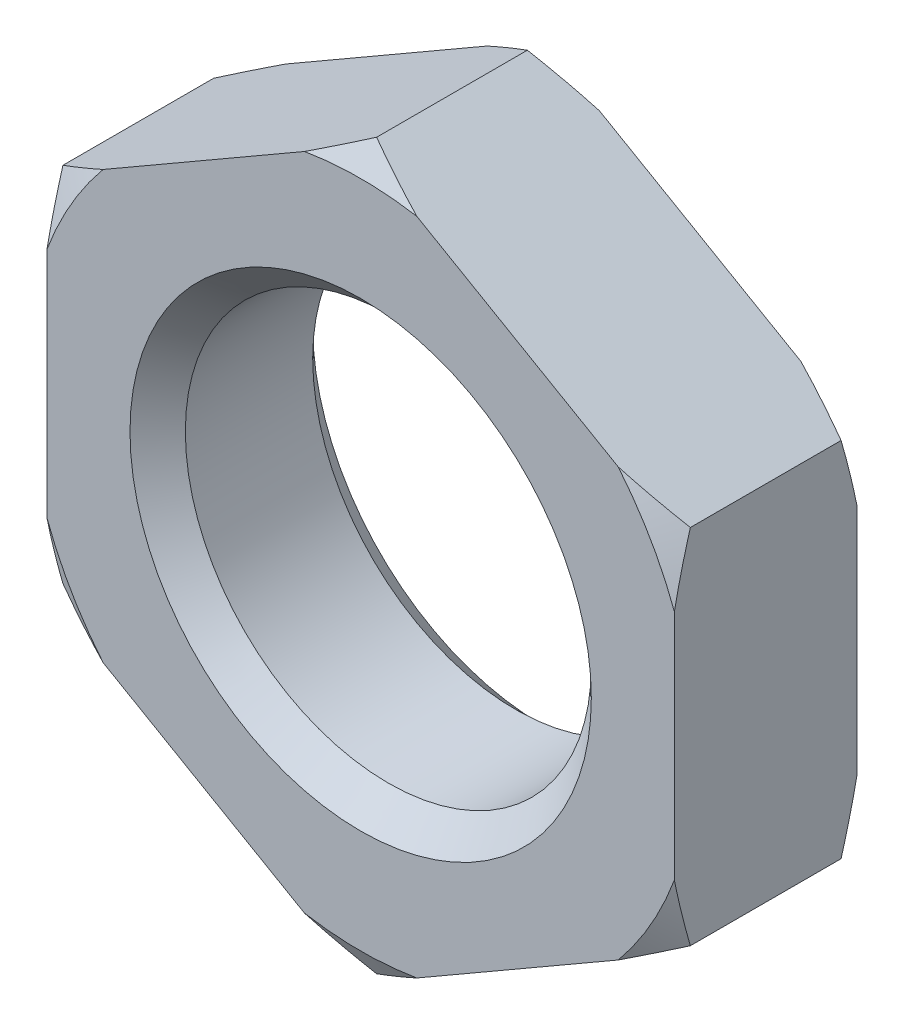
SolidWorks part; units mm, degrees
ref_plane "Front Plane" through (0, 0, 0) normal (0, 0, 1) x (1, 0, 0)
ref_plane "Top Plane" through (0, 0, 0) normal (0, 1, 0) x (1, 0, 0)
ref_plane "Right Plane" through (0, 0, 0) normal (1, 0, 0) x (0, 0, -1)
sketch "Sketch1" plane through (0, 0, 0) normal (0, 0, 1) x (1, 0, 0)
  line L1 (0, 19.6299) -> (-17, 9.815)
  line L2 (-17, 9.815) -> (-17, -9.815)
  line L3 (-17, -9.815) -> (0, -19.6299)
  line L4 (0, -19.6299) -> (17, -9.815)
  line L5 (17, -9.815) -> (17, 9.815)
  line L6 (17, 9.815) -> (0, 19.6299)
  circle A0 centre (0, 0) radius 17 construction
  circle A1 centre (0, 0) radius 11
  dimension "D2" = 22
  dimension "D1" = 34
extrude "Boss-Extrude1" add sketch "Sketch1" along normal mid plane 9.9
sketch "Sketch2" plane through (0, 0, 0) normal (1, 0, 0) x (0, 0, -1)
  line L0 (7.477, 0) -> (-8.5759, 0) construction
sketch "Sketch3" plane through (0, 0, 0) normal (1, 0, 0) x (0, 0, -1)
  line L0 (-4.95, 19.6299) -> (-4.95, 18.1299)
  line L1 (-4.95, 9.815) -> (-4.95, 19.6299) construction
  line L2 (-4.95, 18.1299) -> (-4.084, 19.6299)
  line L3 (-4.95, 19.6299) -> (4.95, 19.6299) construction
  line L4 (-4.084, 19.6299) -> (-4.95, 19.6299)
  dimension "D1" = 1.5
  dimension "D2" = 30
revolve "Cut-Revolve1" cut sketch "Sketch3" angle 360 about L0
mirror "Mirror1" about plane through (0, 0, 0) normal (0, 0, 1) of "Cut-Revolve1"
chamfer "Chamfer1" distance 1.5 angle 45 2 edges at (11, 0, -4.95) (11, 0, 4.95)
